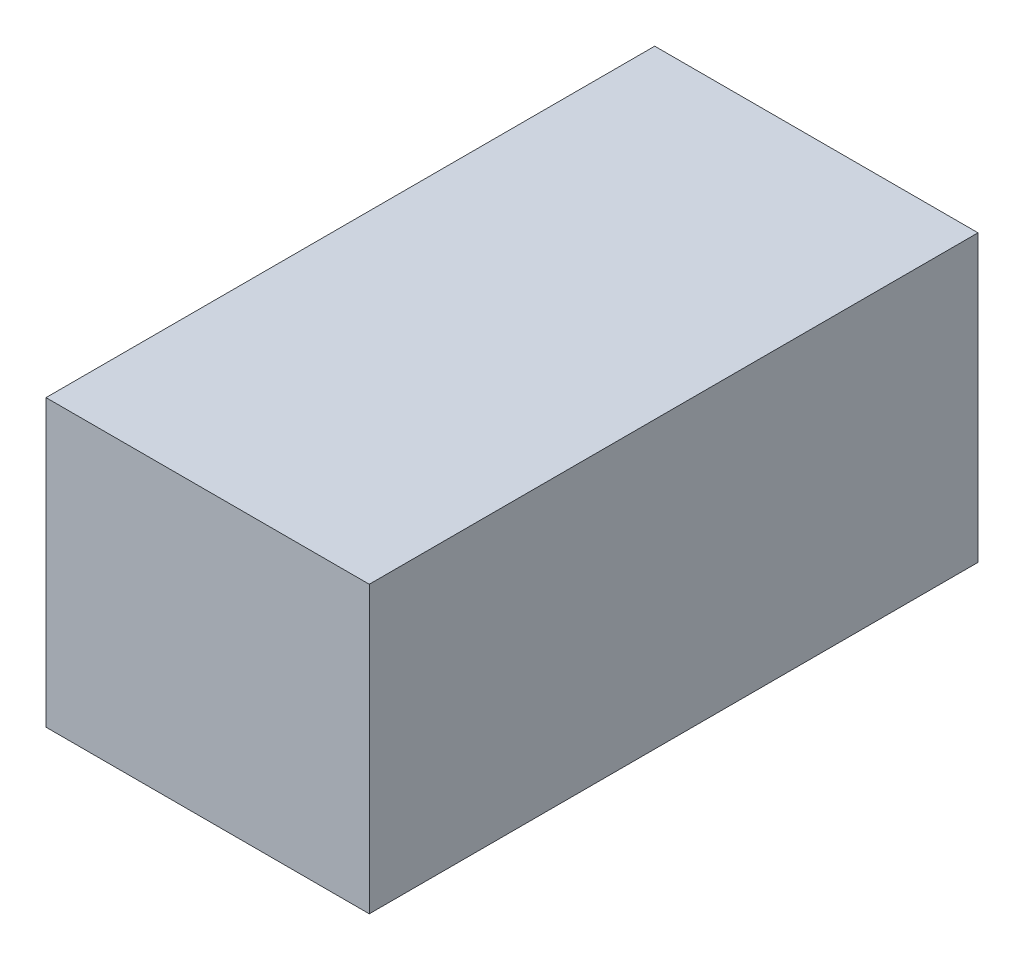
SolidWorks part; units mm, degrees
ref_plane "Front Plane" through (0, 0, 0) normal (0, 0, 1) x (1, 0, 0)
ref_plane "Top Plane" through (0, 0, 0) normal (0, 1, 0) x (1, 0, 0)
ref_plane "Right Plane" through (0, 0, 0) normal (1, 0, 0) x (0, 0, -1)
sketch "Sketch1" plane through (0, 0, 0) normal (0, 0, 1) x (1, 0, 0)
  line L1 (-11.938, -10.541) -> (11.938, -10.541)
  line L2 (-11.938, -10.541) -> (-11.938, 10.541)
  line L3 (-11.938, 10.541) -> (11.938, 10.541)
  line L4 (11.938, -10.541) -> (11.938, 10.541)
  line L5 (-11.938, -10.541) -> (11.938, 10.541) construction
  line L6 (-11.938, 10.541) -> (11.938, -10.541) construction
  point P0 (0, 0)
  dimension "D1" = 23.876
  dimension "D2" = 21.082
extrude "Boss-Extrude1" add sketch "Sketch1" along normal blind 44.958
